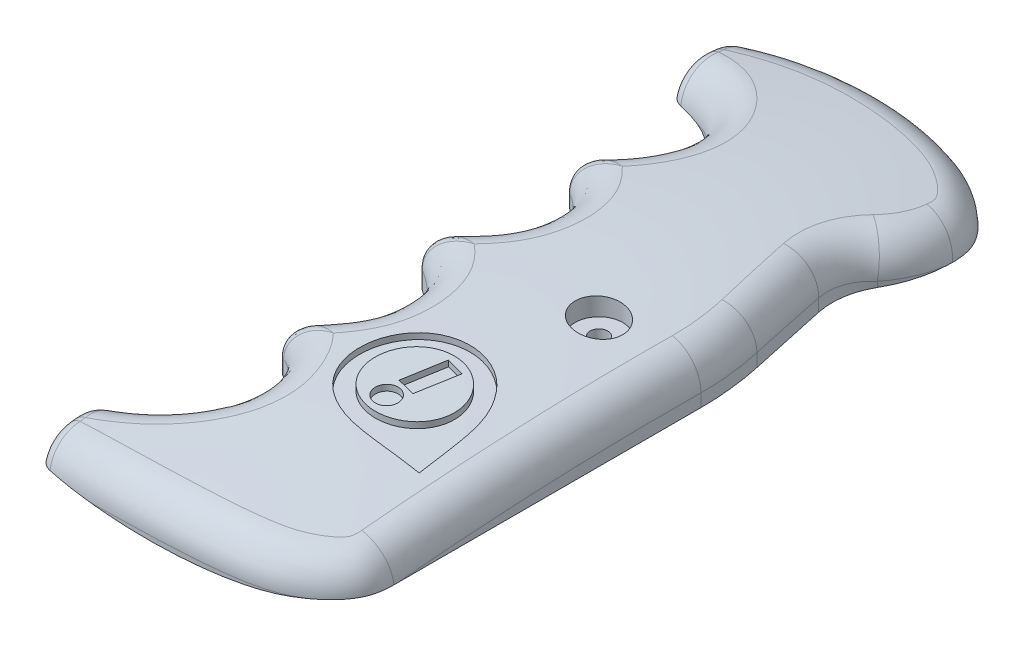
SolidWorks part; units mm, degrees
ref_plane "Alzado" through (0, 0, 0) normal (0, 0, 1) x (1, 0, 0)
ref_plane "Planta" through (0, 0, 0) normal (0, 1, 0) x (1, 0, 0)
ref_plane "Vista lateral" through (0, 0, 0) normal (1, 0, 0) x (0, 0, -1)
sketch "Croquis1"
surface "Superficie-Extruir1" sketch "Croquis1" parameters "D1"=15
sketch "Croquis2" plane through (0, 0, 0) normal (0, 0, 1) x (1, 0, 0)
  line L0 (-35.5, 0) -> (-35.5, 15) construction
  line L1 (12.5, 0) -> (12.5, 15) construction
  arc A0 (-35.5, 7) -> (12.5, 7) centre (-11.5, -90.0773) cw
  point P8 (-11.5, 9.9227)
  dimension "D2" = 100
  dimension "D1" = 7
fillet "Redondeo4" radius 50 1 edges at (12.5, 7.5, -10)
ref_plane "Plano1" through (-11.5, 0, 0) normal (1, 0, 0) x (0, 0, -1)
sketch "Croquis4" plane through (-11.5, 0, 0) normal (1, 0, 0) x (0, 0, -1)
  arc A0 (-64.5131, 5.7433) -> (64.5131, 5.7433) centre (0, -490.0773) cw
  point P8 (0, 9.9227)
  dimension "D1" = 500
other "Límite-Superficie1"
surface "Superficie-Recortar3"
surface "Superficie-Recortar4"
surface "Superficie-Plano1"
surface "Superficie-Coser1"
fillet "Redondeo2" radius 6 10 edges
fillet "Redondeo3" radius 2 3 edges at (-24.4668, 7.8588, 24.2759) (-25.5724, 8.2264, 0) (-24.4668, 7.8588, -24.2759)
ref_plane "Plano2" through (0, 10, 0) normal (0, 1, 0) x (1, 0, 0)
sketch "Croquis5" plane through (0, 0, 0) normal (0, 1, 0) x (1, 0, 0)
  line L0 (0, 0) -> (38.2222, 0) construction
  circle A0 centre (0, 0) radius 1.5
  dimension "D1" = 3
fillet "Redondeo5" radius 3 6 edges at (-35.5, 2.438, -57.278) (-35.5, 3.2448, 49.8195) (-35.5, 3.2384, -49.8095) (-35.5, 3.1211, 56.4526)
sketch "Croquis6" plane through (0, 10, 0) normal (0, 1, 0) x (1, 0, 0)
  circle A0 centre (0, 0) radius 4
  dimension "D1" = 8
sketch "Croquis8" plane through (0, 10, 0) normal (0, 1, 0) x (1, 0, 0)
  line L0 (29.1386, 100.2201) -> (49.1386, 100.2201) construction
  line L1 (-6.2717, -19.0638) -> (-3.3373, -19.6875)
  line L2 (-3.3373, -19.6875) -> (-4.7927, -26.5346)
  line L3 (-4.7927, -26.5346) -> (-7.7271, -25.9108)
  line L4 (-7.7271, -25.9108) -> (-6.2717, -19.0638)
  line L5 (5.5, -35.75) -> (-6, -25) construction
  line L6 (-6.8316, -28.9126) -> (-4.8045, -19.3757) construction
  line L7 (-6, -25) -> (-6, -35.2896) construction
  circle A0 centre (-6, -25) radius 7
  arc A1 (1.642, -18.904) -> (-11.5676, -33.0351) centre (-6, -25) ccw
  circle A2 centre (-6.8316, -28.9126) radius 2
  spline S0 degree 3 poles (5.5, -35.75) (2.8736, -35.6902) (-1.2506, -35.8169) (-7.1507, -35.3029) (-10.1084, -34.0462) (-11.5676, -33.0351) knots 0 0 0 0 0.448077 0.709902 1 1 1 1
  spline S1 degree 3 poles (5.5, -35.75) (5.2635, -33.1336) (5.1122, -29.0102) (4.202, -23.1581) (2.749, -20.2918) (1.642, -18.904) knots 0 0 0 0 0.448077 0.709902 1 1 1 1
  point P4 (-6, -25)
  point P20 (-6.2599, -26.2227)
  dimension "D4" = 14
  dimension "D5" = 9.7755
  dimension "D6" = 4
  dimension "D1" = 20
  dimension "D2" = 6
  dimension "D3" = 25
  dimension "D7" = 3
  dimension "D8" = 7
  dimension "D9" = 12
  dimension "D10" = 2.75
  dimension "D11" = 11.5
  dimension "D12" = 10.75
  dimension "D13" = 1.25
sketch "Croquis9" plane through (0, 0, 0) normal (0, -1, 0) x (1, 0, 0)
  line L1 (0, -4.6188) -> (4, -2.3094)
  line L2 (4, -2.3094) -> (4, 2.3094)
  line L3 (4, 2.3094) -> (0, 4.6188)
  line L4 (0, 4.6188) -> (-4, 2.3094)
  line L5 (-4, 2.3094) -> (-4, -2.3094)
  line L6 (-4, -2.3094) -> (0, -4.6188)
  circle A0 centre (0, 0) radius 4 construction
  dimension "D1" = 8
mirror "Simetría1" [suppressed] about plane through (0, 0, 0) normal (0, 1, 0)
delete or keep bodies "Sólido-Eliminar/Conservar 1" [suppressed] type delete bodies bodies 117
mirror "Simetría2" [suppressed] about plane through (0, 0, 0) normal (0, 1, 0)
delete or keep bodies "Sólido-Eliminar/Conservar 2" [suppressed] type delete bodies bodies 110
extrude "Cortar-Extruir1" cut sketch "Croquis5" along normal up to surface (9.257 mm away)
extrude "Cortar-Extruir2" cut sketch "Croquis6" against normal blind 3.5
extrude "Cortar-Extruir3" cut sketch "Croquis9" against normal blind 3.5
extrude "Cortar-Extruir4" cut sketch "Croquis8" against normal offset from surface (2.3116 mm away) 1 contours S0 S1 A1 A0 | A2 | L4 L3 L2 L1
equation "\"D7@Croquis1\"=\"D6@Croquis1\""
equation "\"D10@Croquis1\"=\"D9@Croquis1\""
